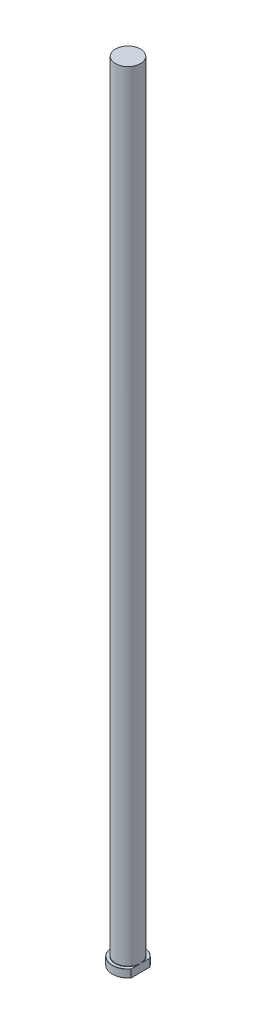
SolidWorks part; units mm, degrees
ref_plane "Front Plane" through (0, 0, 0) normal (0, 0, 1) x (1, 0, 0)
ref_plane "Top Plane" through (0, 0, 0) normal (0, 1, 0) x (1, 0, 0)
ref_plane "Right Plane" through (0, 0, 0) normal (1, 0, 0) x (0, 0, -1)
sketch "Sketch1" plane through (0, 0, 0) normal (0, 0, 1) x (1, 0, 0)
  line L0 (0, 259.9588) -> (0, -15.1925) construction
  line L1 (0, 0) -> (-20, 0)
  line L2 (-20, 0) -> (-20, 10)
  line L3 (-20, 10) -> (-16, 10)
  line L4 (-16, 10) -> (-16, 1000)
  line L5 (-16, 1000) -> (0, 1000)
  line L6 (0, 1000) -> (0, 0)
  dimension "L" = 1000
  dimension "H" = 40
  dimension "T" = 10
  dimension "D" = 32
revolve "Revolve1" add sketch "Sketch1" angle 360 about L0
chamfer "Chamfer1" distance 0.2 angle 45 2 edges at (0, 10, 20) (0, 0, 20)
fillet "Fillet1" radius 0.3 1 edges at (0, 10, 16)
sketch "Sketch2" plane through (0, 0, 0) normal (0, 1, 0) x (1, 0, 0)
  line L0 (16, 12) -> (16, -12)
  circle A0 centre (0, 0) radius 20 construction
  arc A1 (16, -12) -> (16, 12) centre (0, 0) ccw
  circle A2 centre (0, 0) radius 16 construction
extrude "KEY" cut sketch "Sketch2" along normal through all
